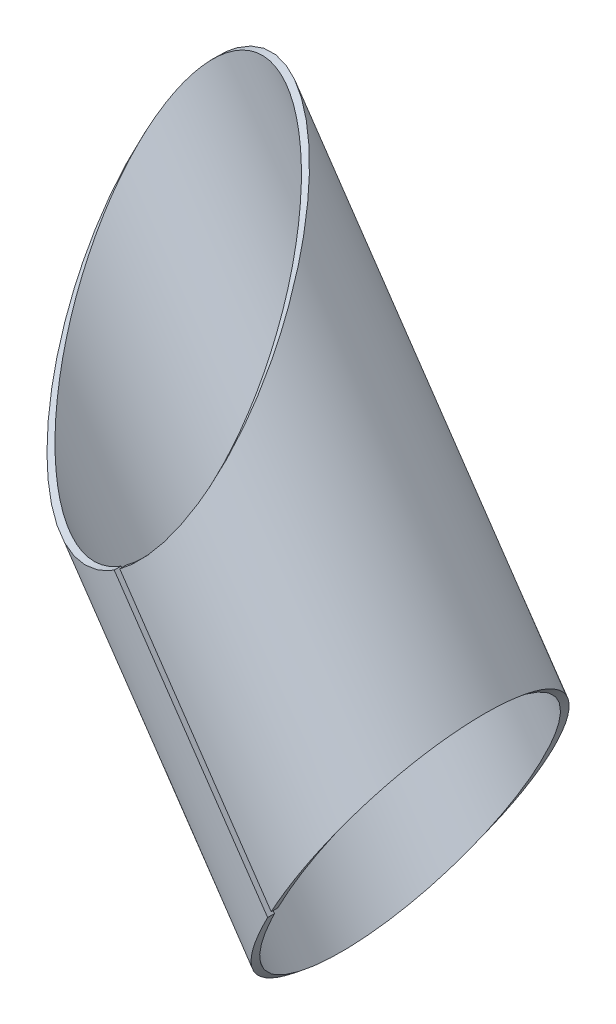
SolidWorks part; units mm, degrees
ref_plane "前视基准面" through (0, 0, 0) normal (0, 0, 1) x (1, 0, 0)
ref_plane "上视基准面" through (0, 0, 0) normal (0, 1, 0) x (1, 0, 0)
ref_plane "右视基准面" through (0, 0, 0) normal (1, 0, 0) x (0, 0, -1)
imported_body "基体零件-双扭向90°和任意角度蛇形弯管-1"
sheet metal parameters "钣金1" parameters "D1"=0.7366, "厚度"=1
bend "圆角折弯1" bend radius 19.786 bend angle 357.243 parameters "D5"=1
flatten bends "展开-折弯1" parameters "D1"=0
sketch "尖角-草图1" plane through (-10.9225, 16.8437, 20.78) normal (0.0199, 0.0136, 0.9997) x (0.9998, -0.0003, -0.0198)
  line L0 (39.7096, 51.1886) -> (62.2353, 18.2866) construction
process bends "加工-折弯1" parameters "D1"=0
sketch "平面-草图1" plane through (-10.9225, 16.8437, 20.78) normal (0.0199, 0.0136, 0.9997) x (0.9998, -0.0003, -0.0198)
